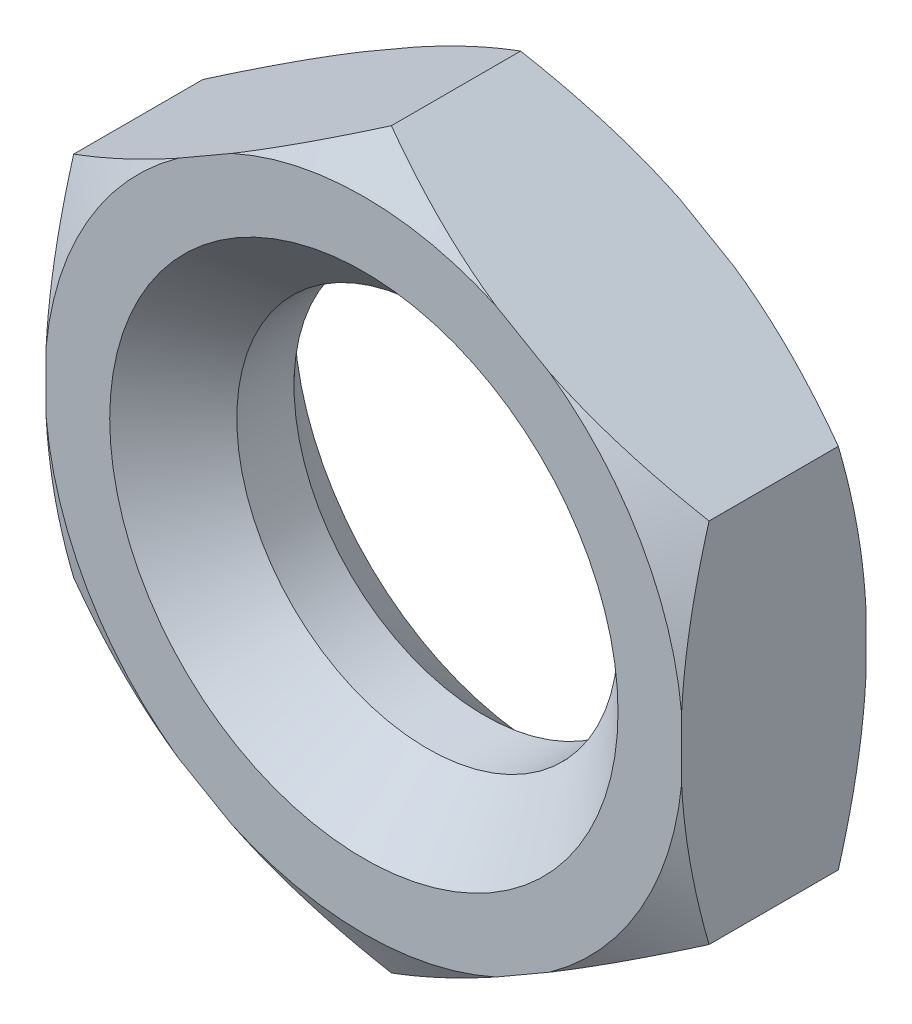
SolidWorks part; units mm, degrees
ref_plane "Front Plane" through (0, 0, 0) normal (0, 0, 1) x (1, 0, 0)
ref_plane "Top Plane" through (0, 0, 0) normal (0, 1, 0) x (1, 0, 0)
ref_plane "Right Plane" through (0, 0, 0) normal (1, 0, 0) x (0, 0, -1)
sketch "Sketch3" plane through (0, 0, 0) normal (0, 0, 1) x (1, 0, 0)
  line L1 (0, 5.7735) -> (-5, 2.8868)
  line L2 (-5, 2.8868) -> (-5, -2.8868)
  line L3 (-5, -2.8868) -> (0, -5.7735)
  line L4 (0, -5.7735) -> (5, -2.8868)
  line L5 (5, -2.8868) -> (5, 2.8868)
  line L6 (5, 2.8868) -> (0, 5.7735)
  circle A0 centre (0, 0) radius 5 construction
  dimension "D1" = 10
extrude "Boss-Extrude1" add sketch "Sketch3" along normal mid plane 2.9
sketch "Sketch4" plane through (0, 0, 0) normal (1, 0, 0) x (0, 0, -1)
  line L0 (-5.4578, 0) -> (6.1545, 0) construction
sketch "Sketch5" plane through (0, 0, 0) normal (1, 0, 0) x (0, 0, -1)
  line L0 (-1.45, 5.7735) -> (-1.45, 5.0235)
  line L1 (-1.45, 2.8868) -> (-1.45, 5.7735) construction
  line L2 (-1.45, 5.0235) -> (-1.017, 5.7735)
  line L3 (-1.45, 5.7735) -> (1.45, 5.7735) construction
  line L4 (-1.017, 5.7735) -> (-1.45, 5.7735)
  dimension "D1" = 0.75
  dimension "D2" = 30
revolve "Cut-Revolve1" cut sketch "Sketch5" angle 360 about L0
mirror "Mirror1" about plane through (0, 0, 0) normal (0, 0, 1) of "Cut-Revolve1"
sketch "Sketch6" plane through (0, 0, 1.45) normal (0, 0, 1) x (1, 0, 0)
  circle A0 centre (0, 0) radius 3
  dimension "D1" = 6
extrude "Cut-Extrude1" cut sketch "Sketch6" against normal blind 2.9
chamfer "Chamfer1" distance 1 angle 45 2 edges at (3, 0, -1.45) (3, 0, 1.45)
